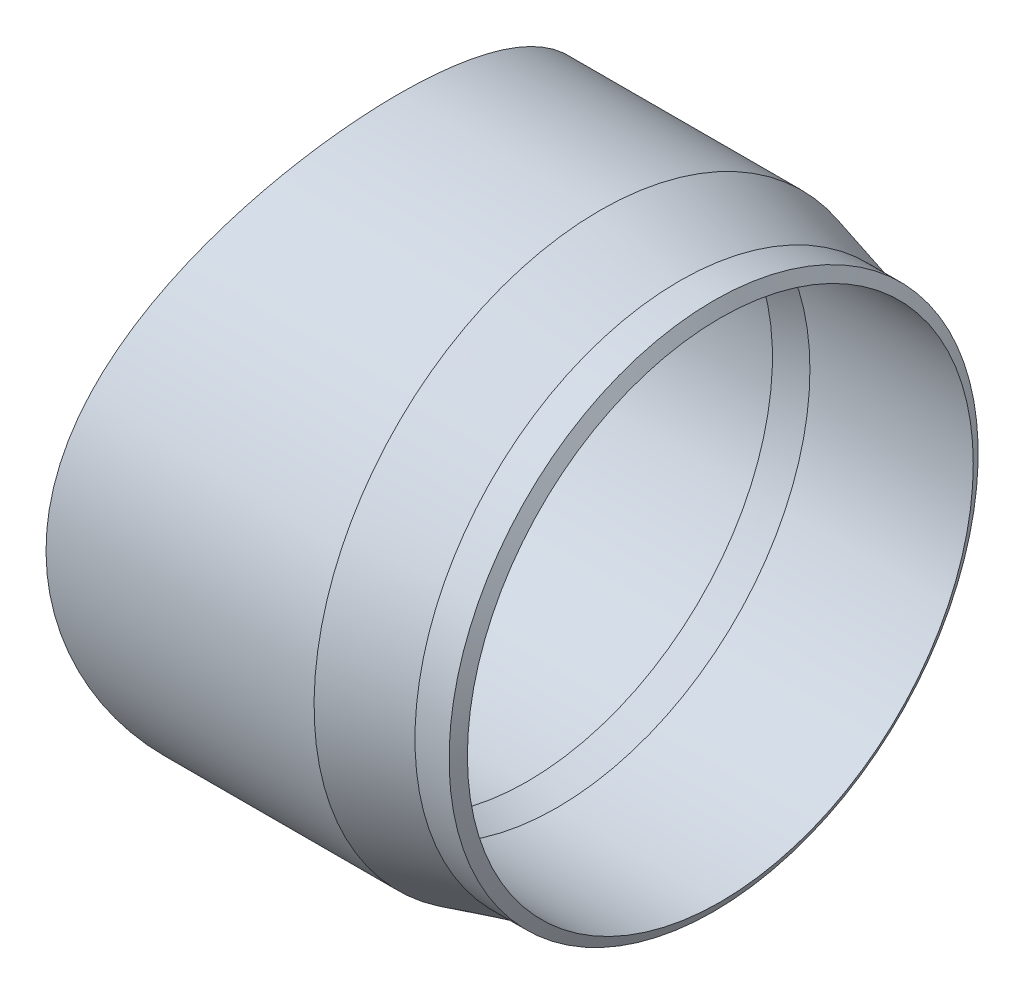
SolidWorks part; units mm, degrees
ref_plane "Ebene vorne" through (0, 0, 0) normal (0, 0, 1) x (1, 0, 0)
ref_plane "Ebene oben" through (0, 0, 0) normal (0, 1, 0) x (1, 0, 0)
ref_plane "Ebene rechts" through (0, 0, 0) normal (1, 0, 0) x (0, 0, -1)
sketch "Skizze3" plane through (0, 0, 0) normal (0, 0, 1) x (1, 0, 0)
  line L0 (561.3259, 0) -> (0, 0) construction
  line L2 (0, 0) -> (0, 350.1492) construction
  line L3 (522, 161.95) -> (497, 161.95)
  line L4 (497, 161.95) -> (448.2967, 175)
  line L5 (448.2967, 175) -> (222, 175)
  line L6 (222, 175) -> (222, 0)
  line L8 (222, 0) -> (522, 0)
  line L9 (522, 0) -> (522, 161.95)
  dimension "D1" = 323.9
  dimension "D2" = 522
  dimension "D3" = 25
  dimension "D4" = 15
  dimension "D5" = 300
  dimension "D6" = 350
revolve "Rotation1" add sketch "Skizze3" angle 360 about L0
sketch "Skizze5" plane through (522, 0, 0) normal (1, 0, 0) x (0, 0, -1)
  circle A0 centre (0, 0) radius 154.85
  circle A1 centre (0, 0) radius 161.95 construction
  dimension "D1" = 7.1
extrude "Schnitt-Linear austragen2" cut sketch "Skizze5" against normal blind 100
sketch "Skizze6" plane through (422, 0, 0) normal (1, 0, 0) x (0, 0, -1)
  circle A1 centre (0, 0) radius 154.85
  circle A2 centre (0, 0) radius 154.85
  dimension "D1" = 0
extrude "Schnitt-Linear austragen3" cut sketch "Skizze6" against normal blind 30 draft 15
sketch "Skizze7" plane through (522, 0, 0) normal (1, 0, 0) x (0, 0, -1)
  circle A0 centre (0, 0) radius 150
  dimension "D1" = 300
extrude "Schnitt-Linear austragen4" cut sketch "Skizze7" against normal through all
sketch "Skizze11" plane through (0, 0, 0) normal (0, 1, 0) x (1, 0, 0)
  circle A0 centre (0, 0) radius 315
  dimension "D1" = 315
extrude "Schnitt-Linear austragen5" cut sketch "Skizze11" against normal through all and the other way through all
chamfer "Aussenfase_Gehäuse" distance 10 angle 60 1 edges at (314.991, -174.9839, 2.377)
chamfer "Innenfase_Gehäuse" distance 5 angle 45 1 edges at (314.5509, -149.0547, 16.8138)
chamfer "Fase_für_Flansch" distance 7.1 angle 30 1 edges at (522, 161.95, 0)
